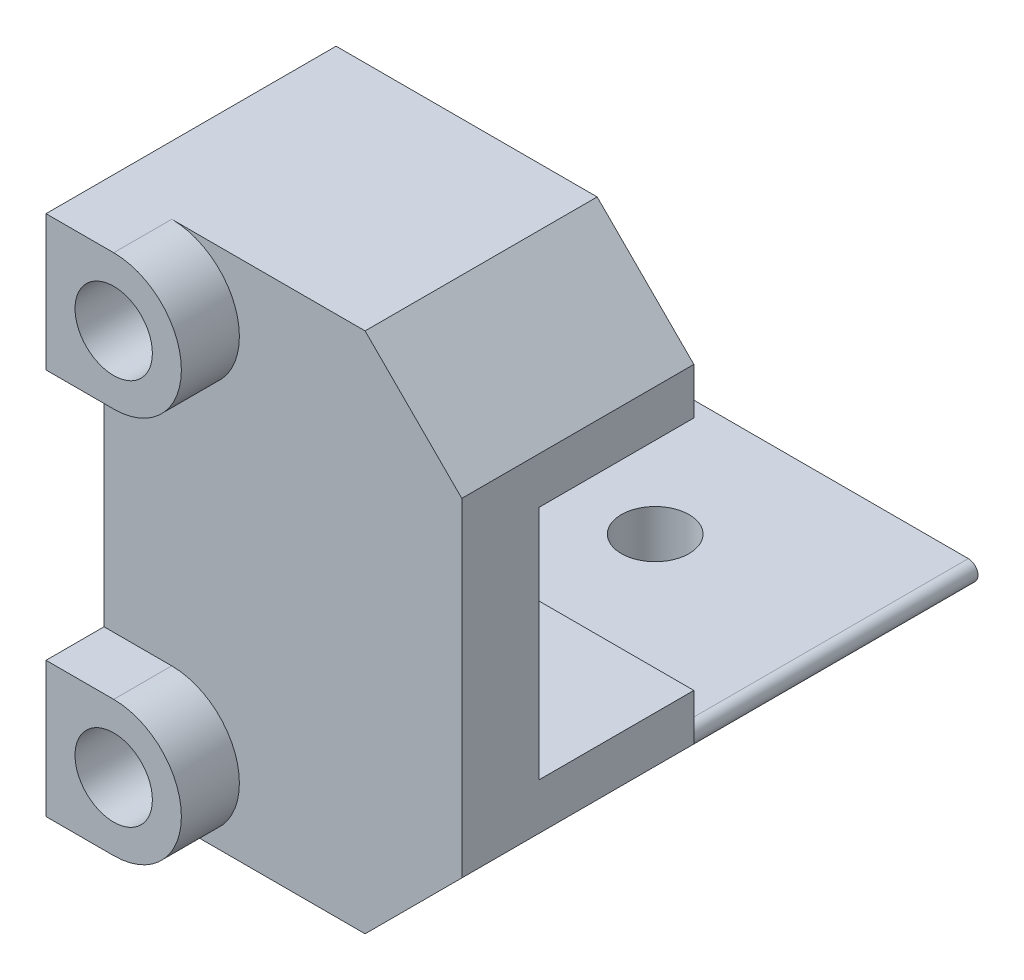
SolidWorks part; units mm, degrees
ref_plane "Ebene vorne" through (0, 0, 0) normal (0, 0, 1) x (1, 0, 0)
ref_plane "Ebene oben" through (0, 0, 0) normal (0, 1, 0) x (1, 0, 0)
ref_plane "Ebene rechts" through (0, 0, 0) normal (1, 0, 0) x (0, 0, -1)
sketch "Skizze1" plane through (0, 0, 0) normal (0, 0, 1) x (1, 0, 0)
  line L1 (-9.25, -13.5) -> (9.25, -13.5)
  line L2 (-9.25, -13.5) -> (-9.25, 13.5)
  line L3 (-9.25, 13.5) -> (9.25, 13.5)
  line L4 (9.25, -13.5) -> (9.25, 13.5)
  line L5 (-9.25, -13.5) -> (9.25, 13.5) construction
  line L6 (-9.25, 13.5) -> (9.25, -13.5) construction
  point P0 (0, 0)
  dimension "D1" = 18.5
  dimension "D2" = 27
extrude "Aufsatz-Linear austragen1" add sketch "Skizze1" along normal blind 12
sketch "Skizze2" plane through (-9.25, 0, 0) normal (-1, 0, 0) x (0, 0, 1)
  line L0 (0, 13.5) -> (0, -13.5) construction
  line L1 (0, 6.1) -> (8, 6.1)
  line L2 (0, 6.1) -> (0, -6.1)
  line L3 (0, -6.1) -> (8, -6.1)
  line L4 (8, 6.1) -> (8, -6.1)
  point P6 (0, 0)
  dimension "D1" = 8
  dimension "D2" = 12.2
extrude "Schnitt-Linear austragen1" cut sketch "Skizze2" against normal through all
sketch "Skizze5" plane through (0, 0, 12) normal (0, 0, 1) x (1, 0, 0)
  line L0 (-9.25, 13.5) -> (-9.25, -13.5) construction
  circle A0 centre (-5.75, 10) radius 3.5
  circle A1 centre (-5.75, -10) radius 3.5
  dimension "D2" = 10
  dimension "D3" = 10
  dimension "D4" = 7
  dimension "D1" = 3.5
extrude "Aufsatz-Linear austragen2" add sketch "Skizze5" along normal blind 3
hole_wizard "Ø4.0 (4) Durchmesser Bohrung2" positions "Skizze6" profile "Skizze8" hole size "Ø4.0" standard "DIN"
sketch "Skizze6" plane through (0, 0, 15) normal (0, 0, 1) x (1, 0, 0)
  point P0 (-5.75, 10)
  point P3 (-5.75, -10)
sketch "Skizze8" plane through (-5.75, 10, 15) normal (1, 0, 0) x (0, -1, 0)
  line L0 (0, 0) -> (0, 6.5)
  line L1 (0, 6.5) -> (2, 6.5)
  line L2 (2, 6.5) -> (2, 0)
  line L5 (2, 0) -> (0, 0)
  line L10 (0, 6.5) -> (-2, 6.5) construction
  line L11 (0, -6.35) -> (0, 107.95) construction
  dimension "Bohrerdurchmesser" = 4
  dimension "Bohrungstiefe" = 6.5
  dimension "Spitzenwinkel" = 180
chamfer "Fase1" distance 5 angle 45 2 edges at (9.25, -13.5, 6) (9.25, 13.5, 6)
sketch "Skizze9" plane through (0, 0, 15) normal (0, 0, 1) x (1, 0, 0)
  line L0 (-5.75, 6.5) -> (-9.25, 6.5)
  line L1 (-9.25, 10) -> (-9.25, -10) construction
  line L2 (-9.25, 6.5) -> (-9.25, 13.5)
  line L3 (-9.25, 13.5) -> (-9.25, 10) construction
  line L4 (-9.25, 13.5) -> (-5.75, 13.5)
  line L5 (-5.75, 13.5) -> (-9.25, 13.5) construction
  line L6 (-5.75, -6.5) -> (-9.25, -6.5)
  line L7 (-9.25, -6.5) -> (-9.25, -13.5)
  line L8 (-9.25, -13.5) -> (-5.75, -13.5)
  arc A0 (-9.25, 10) -> (-5.75, 13.5) centre (-5.75, 10) ccw construction
  circle A1 centre (-5.75, 10) radius 3.5 construction
  arc A2 (-5.75, 13.5) -> (-5.75, 6.5) centre (-5.75, 10) ccw
  circle A3 centre (-5.75, -10) radius 3.5 construction
  arc A4 (-5.75, -13.5) -> (-9.25, -10) centre (-5.75, -10) ccw construction
  arc A5 (-5.75, -13.5) -> (-5.75, -6.5) centre (-5.75, -10) cw
extrude "Aufsatz-Linear austragen3" add sketch "Skizze9" against normal up to surface (3 mm away) contours L2 L0 M2 | L4 L2 M2 | L7 A5 L6 | L8 A5 L7
sketch "Skizze10" plane through (0, 0, 0) normal (0, 0, -1) x (-1, 0, 0)
  line L5 (-9.25, -6.1) -> (-9.25, -8.5)
  line L6 (-9.25, -8.5) -> (-4.25, -13.5)
  line L7 (-4.25, -13.5) -> (9.25, -13.5)
  line L8 (9.25, -13.5) -> (9.25, -6.1)
  line L9 (9.25, -6.1) -> (-9.25, -6.1)
  line L10 (-9.25, -6.1) -> (-9.25, -8.5)
  line L11 (-9.25, -8.5) -> (-4.25, -13.5)
  line L12 (-4.25, -13.5) -> (9.25, -13.5)
  line L13 (9.25, -13.5) -> (9.25, -6.1)
  line L14 (9.25, -6.1) -> (-9.25, -6.1)
  dimension "D1" = 0
extrude "Aufsatz-Linear austragen4" add sketch "Skizze10" along normal blind 17
sketch "Skizze11" plane through (9.25, 0, 0) normal (1, 0, 0) x (0, 0, -1)
  line L0 (0, 13.5) -> (0, 8.5) construction
  line L1 (17, -6.1) -> (0, -6.1)
  line L2 (17, -6.1) -> (17, -10.1)
  line L3 (17, -10.1) -> (0, -10.1)
  line L4 (0, -6.1) -> (0, -10.1)
  line L5 (17, -6.1) -> (-8, -6.1) construction
  dimension "D1" = 4
extrude "Schnitt-Linear austragen2" cut sketch "Skizze11" against normal through all
fillet "Verrundung2" radius 0.5 1 edges at (7.65, -10.1, -8.5)
hole_wizard "Ø3.5 (3.5) Durchmesser Bohrung2" positions "Skizze15" profile "Skizze16" hole size "Ø3.5" standard "DIN"
sketch "Skizze15" plane through (0, -13.5, 0) normal (0, -1, 0) x (-1, 0, 0)
  line L0 (-4.25, 17) -> (9.25, 17) construction
  line L1 (9.25, -15) -> (9.25, 17) construction
  point P0 (2.75, 10)
  dimension "D1" = 7
  dimension "D2" = 6.5
sketch "Skizze16" plane through (-2.75, -13.5, -10) normal (1, 0, 0) x (0, 0, -1)
  line L0 (0, 0) -> (0, 27)
  line L1 (0, 27) -> (1.75, 27)
  line L2 (1.75, 27) -> (1.75, 0)
  line L5 (1.75, 0) -> (0, 0)
  line L11 (0, -6.35) -> (0, 107.95) construction
  dimension "Bohrerdurchmesser" = 3.5
  dimension "Bohrungstiefe" = 27
